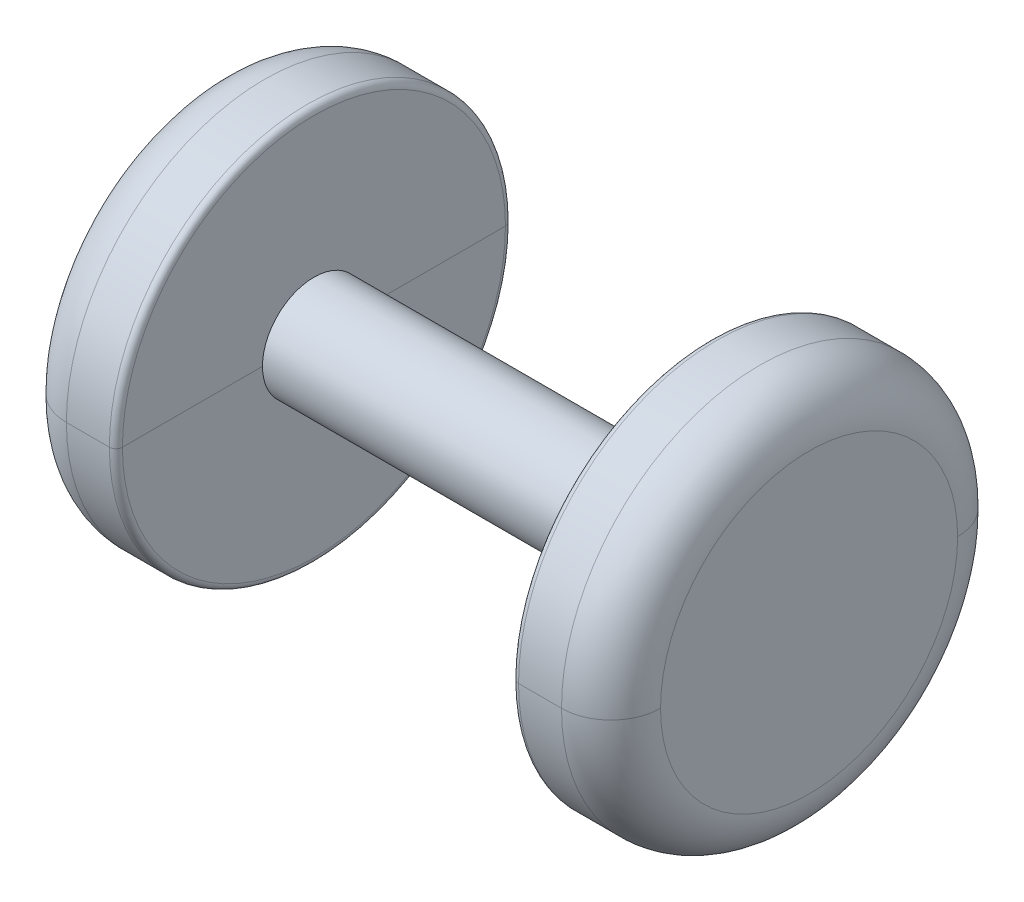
SolidWorks part; units mm, degrees
ref_plane "Front Plane" through (0, 0, 0) normal (0, 0, 1) x (1, 0, 0)
ref_plane "Top Plane" through (0, 0, 0) normal (0, 1, 0) x (1, 0, 0)
ref_plane "Right Plane" through (0, 0, 0) normal (1, 0, 0) x (0, 0, -1)
sketch "Sketch1" plane through (0, 0, 0) normal (1, 0, 0) x (0, 0, -1)
  circle A0 centre (0, 0) radius 6.604
  dimension "D1" = 13.208
extrude "Boss-Extrude1" add sketch "Sketch1" along normal mid plane 76.2
sketch "Sketch2" plane through (38.1, 0, 0) normal (1, 0, 0) x (0, 0, -1)
  circle A0 centre (0, 0) radius 25.4
  dimension "D1" = 50.8
extrude "Boss-Extrude2" add sketch "Sketch2" against normal blind 12.7
sketch "Sketch3" plane through (-38.1, 0, 0) normal (-1, 0, 0) x (0, 0, 1)
  circle A1 centre (0, 0) radius 25.4
  circle A2 centre (0, 0) radius 25.4
  dimension "D1" = 0
extrude "Boss-Extrude3" add sketch "Sketch3" against normal blind 12.7
fillet "Fillet1" radius 6.35 2 edges at (38.1, 0, -25.4) (-38.1, 0, 25.4)
fillet "Fillet2" radius 0.8382 2 edges at (25.4, 0, -25.4) (-25.4, 0, 25.4)
sketch "Sketch4" plane through (38.1, 0, 0) normal (1, 0, 0) x (0, 0, -1)
  line L0 (-69.6703, 0) -> (69.6703, 0)
  point P4 (0, 0)
